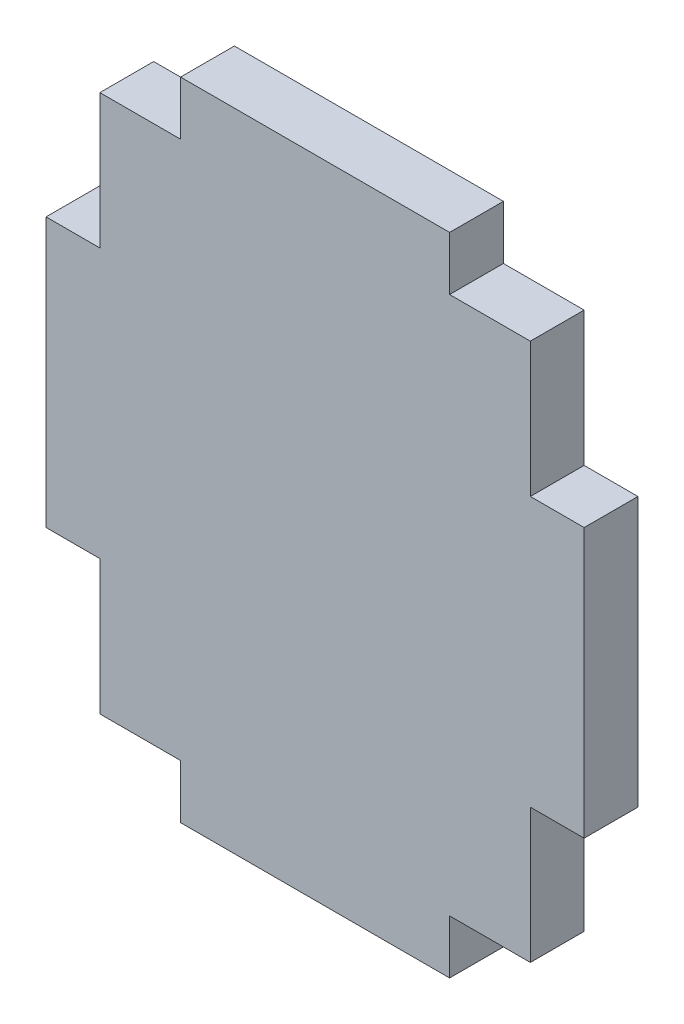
SolidWorks part; units mm, degrees
ref_plane "Alzado" through (0, 0, 0) normal (0, 0, 1) x (1, 0, 0)
ref_plane "Planta" through (0, 0, 0) normal (0, 1, 0) x (1, 0, 0)
ref_plane "Vista lateral" through (0, 0, 0) normal (1, 0, 0) x (0, 0, -1)
sketch "Croquis1" plane through (0, 0, 0) normal (0, 0, 1) x (1, 0, 0)
  line L10 (3, 25.5) -> (0, 25.5)
  line L11 (3, 10.5) -> (0, 10.5)
  line L12 (7.5, 33) -> (7.5, 36)
  line L13 (22.5, 33) -> (22.5, 36)
  line L14 (27, 25.5) -> (30, 25.5)
  line L15 (27, 10.5) -> (30, 10.5)
  line L16 (7.5, 3) -> (7.5, 0)
  line L17 (22.5, 3) -> (22.5, 0)
  line L20 (7.5, 33) -> (3, 33)
  line L21 (22.5, 33) -> (27, 33)
  line L22 (7.5, 3) -> (3, 3)
  line L23 (22.5, 3) -> (27, 3)
  line L24 (7.5, 36) -> (22.5, 36)
  line L25 (7.5, 0) -> (22.5, 0)
  line L26 (27, 25.5) -> (27, 33)
  line L27 (27, 10.5) -> (27, 3)
  line L28 (30, 25.5) -> (30, 10.5)
  line L29 (3, 33) -> (3, 25.5)
  line L30 (0, 10.5) -> (0, 25.5)
  line L31 (3, 10.5) -> (3, 3)
  point P12 (15, 3)
  point P15 (3, 18)
extrude "Saliente-Extruir1" add sketch "Croquis1" along normal blind 3
